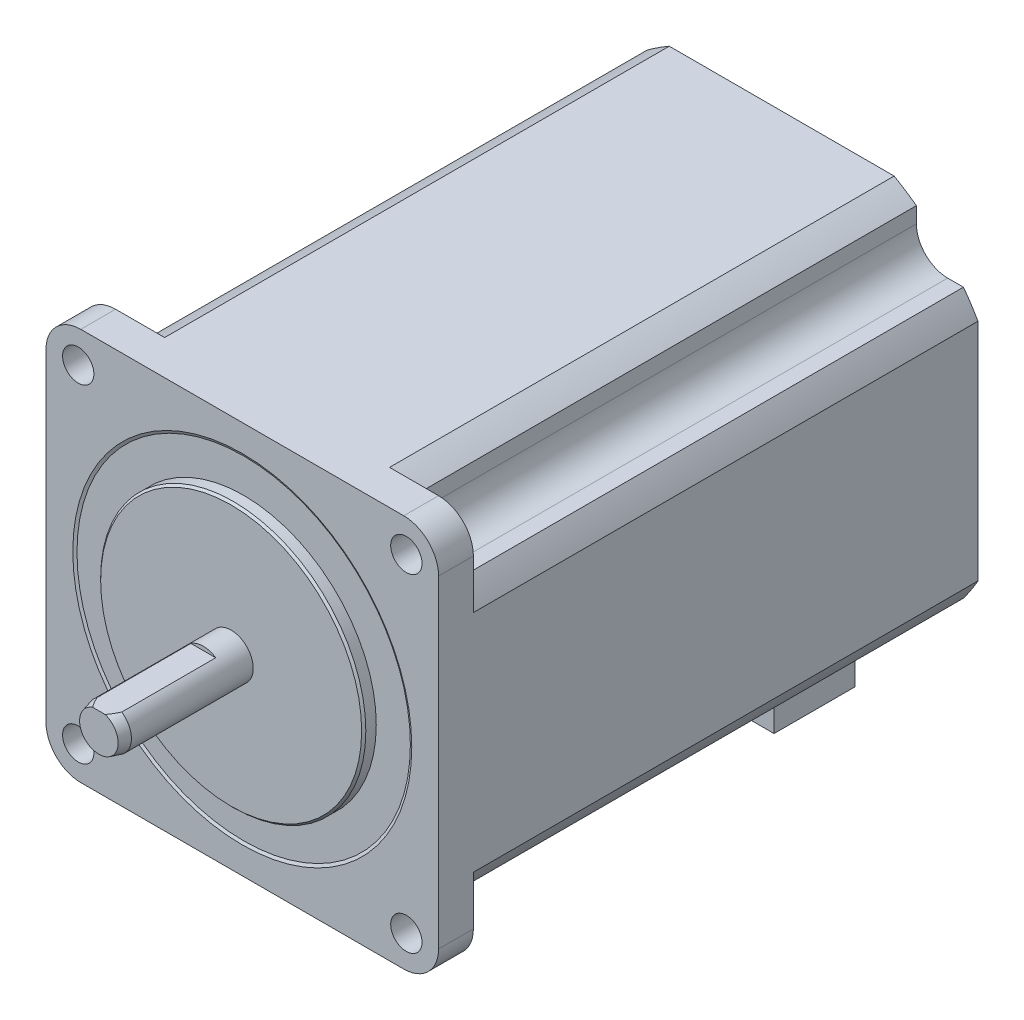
SolidWorks part; units mm, degrees
ref_plane "正面" through (0, 0, 0) normal (0, 0, 1) x (1, 0, 0)
ref_plane "平面" through (0, 0, 0) normal (0, 1, 0) x (1, 0, 0)
ref_plane "右側面" through (0, 0, 0) normal (1, 0, 0) x (0, 0, -1)
sketch "ｽｹｯﾁ1" plane through (0, 0, 0) normal (0, 0, 1) x (1, 0, 0)
  circle A0 centre (0, 0) radius 3.175
  dimension "D1" = 6.35
extrude "押し出し1" add sketch "ｽｹｯﾁ1" along normal blind 19
sketch "ｽｹｯﾁ2" plane through (0, 0, 0) normal (0, 0, -1) x (-1, 0, 0)
  circle A0 centre (0, 0) radius 19.05
  dimension "D1" = 38.1
extrude "押し出し2" add sketch "ｽｹｯﾁ2" along normal blind 1.6
sketch "ｽｹｯﾁ3" plane through (0, 0, -1.6) normal (0, 0, -1) x (-1, 0, 0)
  line L1 (-28.2, 28.2) -> (28.2, 28.2)
  line L2 (-28.2, 28.2) -> (-28.2, -28.2)
  line L3 (-28.2, -28.2) -> (28.2, -28.2)
  line L4 (28.2, 28.2) -> (28.2, -28.2)
  line L5 (-28.2, 28.2) -> (28.2, -28.2) construction
  line L6 (-28.2, -28.2) -> (28.2, 28.2) construction
  line L7 (23.57, 23.57) -> (-23.57, 23.57) construction
  line L8 (23.57, 23.57) -> (23.57, -23.57) construction
  line L9 (23.57, -23.57) -> (-23.57, -23.57) construction
  line L10 (-23.57, 23.57) -> (-23.57, -23.57) construction
  line L11 (23.57, 23.57) -> (-23.57, -23.57) construction
  line L12 (23.57, -23.57) -> (-23.57, 23.57) construction
  circle A0 centre (23.57, 23.57) radius 2.25
  circle A1 centre (-23.57, 23.57) radius 2.25
  circle A2 centre (23.57, -23.57) radius 2.25
  circle A3 centre (-23.57, -23.57) radius 2.25
  point P0 (0, 0)
  point P6 (0, 0)
  dimension "D3" = 47.14
  dimension "D4" = 47.14
  dimension "D6" = 4.5
  dimension "D1" = 56.4
  dimension "D2" = 56.4
extrude "押し出し3" add sketch "ｽｹｯﾁ3" along normal blind 5
fillet "Fillet1" radius 5 4 edges at (28.2, -28.2, -4.1) (-28.2, -28.2, -4.1) (-28.2, 28.2, -4.1) (28.2, 28.2, -4.1)
sketch "ｽｹｯﾁ4" plane through (0, 0, -6.6) normal (0, 0, -1) x (-1, 0, 0)
  line L0 (19.35, 19.35) -> (28.2, 19.35)
  line L1 (-19.35, 28.2) -> (19.35, 28.2)
  line L2 (-19.35, 28.2) -> (-19.35, 19.35)
  line L3 (-19.35, -28.2) -> (19.35, -28.2)
  line L4 (19.35, 28.2) -> (19.35, 19.35)
  line L5 (-19.35, 28.2) -> (19.35, -28.2) construction
  line L6 (-19.35, -28.2) -> (19.35, 28.2) construction
  line L7 (-28.2, 19.35) -> (-19.35, 19.35)
  line L8 (-28.2, 19.35) -> (-28.2, -19.35)
  line L9 (-28.2, -19.35) -> (-19.35, -19.35)
  line L10 (28.2, 19.35) -> (28.2, -19.35)
  line L11 (-28.2, 19.35) -> (28.2, -19.35) construction
  line L12 (-28.2, -19.35) -> (28.2, 19.35) construction
  line L13 (-19.35, -19.35) -> (-19.35, -28.2)
  line L14 (19.35, -19.35) -> (28.2, -19.35)
  line L15 (19.35, -19.35) -> (19.35, -28.2)
  circle A0 centre (0, 0) radius 32.5
  point P0 (0, 0)
  point P6 (0, 0)
  dimension "D5" = 65
  dimension "D1" = 38.7
  dimension "D2" = 56.4
  dimension "D3" = 56.4
  dimension "D4" = 38.7
extrude "押し出し4" add sketch "ｽｹｯﾁ4" along normal blind 72.5 contours L10 A0 L0 L4 L1 L2 L7 L8 L9 L13 L3 L15 L14
fillet "Fillet2" radius 4.5 4 edges at (19.35, -19.35, -42.85) (-19.35, -19.35, -42.85) (-19.35, 19.35, -42.85) (19.35, 19.35, -42.85)
sketch "Sketch1" plane through (0, -28.2, 0) normal (0, -1, 0) x (1, 0, 0)
  line L0 (16.1558, -79.1) -> (-16.1558, -79.1) construction
  line L1 (-10.5, -79.1) -> (10.5, -79.1)
  line L2 (-10.5, -79.1) -> (-10.5, -67.5)
  line L3 (-10.5, -67.5) -> (10.5, -67.5)
  line L4 (10.5, -79.1) -> (10.5, -67.5)
  dimension "D1" = 11.6
  dimension "D2" = 21
  dimension "D3" = 10.5
extrude "Extrude1" add sketch "Sketch1" along normal blind 10
chamfer "Chamfer5" distance 1.5 angle 15 1 edges at (3.175, 0, 19)
sketch "Sketch2" plane through (0, 0, 19) normal (0, 0, 1) x (1, 0, 0)
  line L1 (-4.7278, 5.1185) -> (3.4221, 5.1185)
  line L2 (-4.7278, 5.1185) -> (-4.7278, 2.625)
  line L3 (-4.7278, 2.625) -> (3.4221, 2.625)
  line L4 (3.4221, 5.1185) -> (3.4221, 2.625)
  dimension "D1" = 2.625
extrude "Extrude2" cut sketch "Sketch2" against normal blind 15
sketch "Sketch6" plane through (0, 0, -1.6) normal (0, 0, 1) x (1, 0, 0)
  circle A0 centre (0, 0) radius 19.05
  circle A1 centre (0, 0) radius 24.35
  dimension "D1" = 48.7
  dimension "D2" = 38.1
extrude "Extrude6" cut sketch "Sketch6" against normal blind 0.2
chamfer "Chamfer6" distance 0.2 distance2 0.4 1 edges at (24.35, 0, -1.8)
chamfer "Chamfer2" distance 0.3 angle 45 1 edges at (-19.05, 0, 0)
